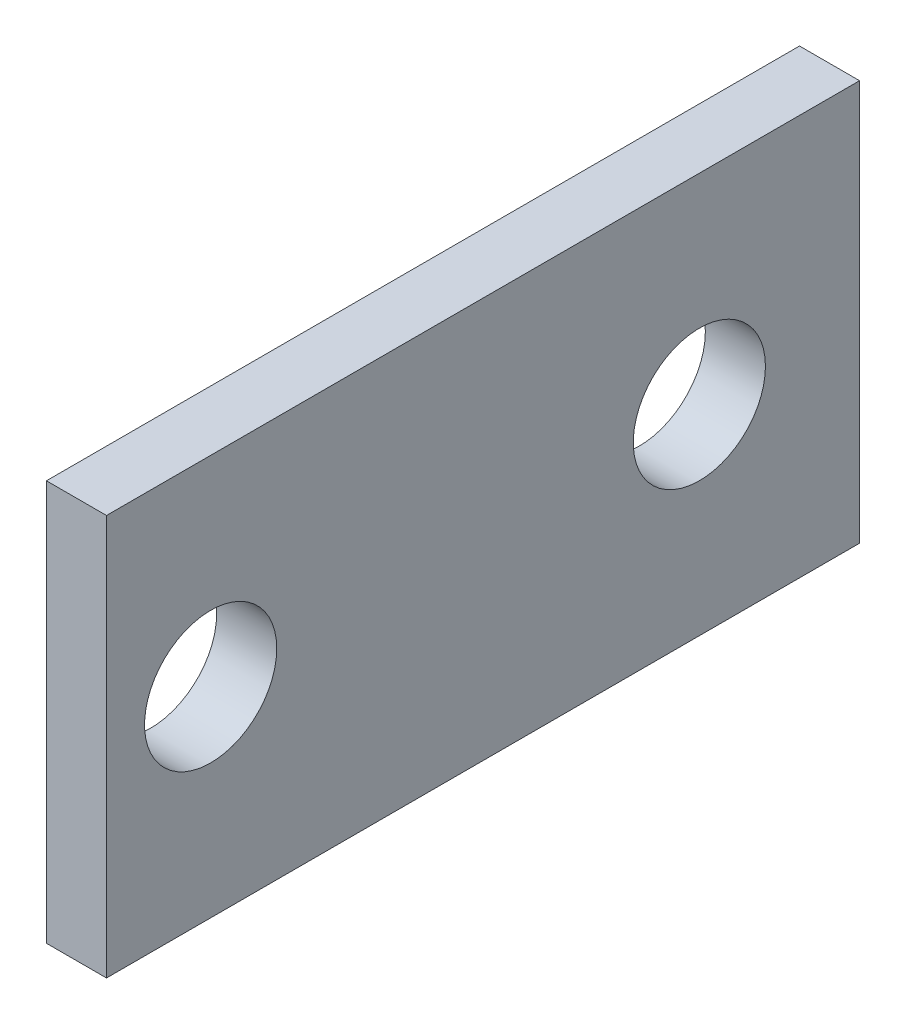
SolidWorks part; units mm, degrees
ref_plane "Přední rovina" through (0, 0, 0) normal (0, 0, 1) x (1, 0, 0)
ref_plane "Horní rovina" through (0, 0, 0) normal (0, 1, 0) x (1, 0, 0)
ref_plane "Pravá rovina" through (0, 0, 0) normal (1, 0, 0) x (0, 0, -1)
sketch "Skica1" plane through (0, 0, 0) normal (1, 0, 0) x (0, 0, -1)
  line L0 (-17.6155, -3.4932) -> (1.1845, -3.4932) construction
  line L1 (-17.6155, 1.5068) -> (1.1845, 1.5068)
  line L2 (-17.6155, 1.5068) -> (-17.6155, -8.4932)
  line L3 (-17.6155, -8.4932) -> (1.1845, -8.4932)
  line L4 (1.1845, 1.5068) -> (1.1845, -8.4932)
  circle A0 centre (-15.0155, -3.4932) radius 1.65
  circle A1 centre (-2.8155, -3.4932) radius 1.65
  dimension "D5" = 4
  dimension "D6" = 3.3
  dimension "D1" = 10
  dimension "D2" = 18.8
  dimension "D4" = 2.6
extrude "Přidat vysunutím1" add sketch "Skica1" along normal blind 1.5
